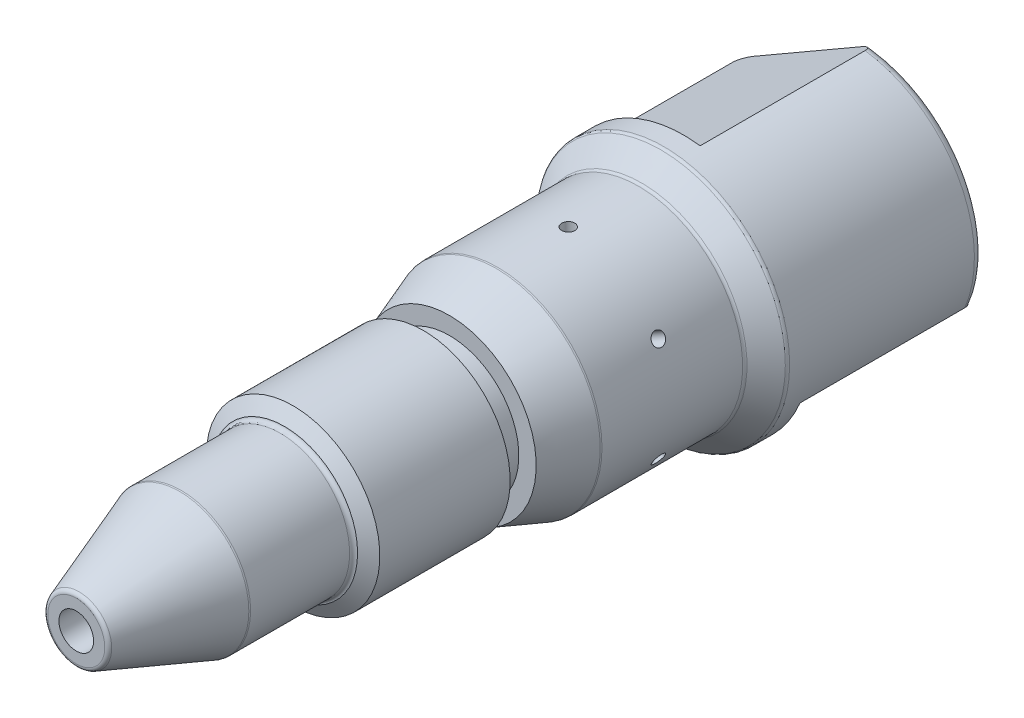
SolidWorks part; units mm, degrees
ref_plane "Front Plane" through (0, 0, 0) normal (0, 0, 1) x (1, 0, 0)
ref_plane "Top Plane" through (0, 0, 0) normal (0, 1, 0) x (1, 0, 0)
ref_plane "Right Plane" through (0, 0, 0) normal (1, 0, 0) x (0, 0, -1)
sketch "Sketch2" plane through (0, 0, 0) normal (0, 1, 0) x (1, 0, 0)
  line L0 (0, 0) -> (0, 45) construction
  line L1 (0, 45) -> (0, 0) construction
  line L2 (0, 0) -> (12.5, 0) construction
  line L4 (0, 0) -> (1.8162, 0)
  line L5 (1.8162, 0) -> (4, 6)
  line L6 (4, 6) -> (4, 12)
  line L7 (4, 12) -> (5, 12)
  line L8 (5, 12) -> (5, 20)
  line L9 (5, 20) -> (4, 20)
  line L10 (4, 20) -> (4, 21.5)
  line L11 (6, 24.2475) -> (6, 32.5)
  line L12 (6, 32.5) -> (7.25, 33.75)
  line L13 (7.25, 33.75) -> (7.25, 45)
  line L14 (0, 45) -> (0, 0)
  line L15 (0, 45) -> (7.25, 45)
  line L16 (4, 21.5) -> (5, 21.5)
  line L17 (5, 21.5) -> (6, 24.2475)
  point P20 (4.5, 20)
  dimension "D2" = 14.5
  dimension "D4" = 45
  dimension "D5" = 12
  dimension "D6" = 10
  dimension "D7" = 8
  dimension "D8" = 20
  dimension "D9" = 1.5
  dimension "D10" = 1
  dimension "D11" = 20
  dimension "D12" = 6
  dimension "D13" = 12
  dimension "D14" = 20
  dimension "D15" = 45
  dimension "D16" = 32.5
revolve "Revolve1" add sketch "Sketch2" angle 360 about L14
sketch "Sketch3" plane through (0, 0, 0) normal (0, 0, 1) x (1, 0, 0)
  circle A0 centre (0, 0) radius 1
  dimension "D1" = 2
extrude "Cut-Extrude1" cut sketch "Sketch3" against normal blind 23
sketch "Sketch4" plane through (0, 0, -45) normal (0, 0, -1) x (-1, 0, 0)
  circle A0 centre (0, 0) radius 3.75
  dimension "D1" = 7.5
extrude "Cut-Extrude3" cut sketch "Sketch4" against normal blind 23
chamfer "Chamfer1" distance 1 angle 60 1 edges at (-3.75, 0, -45)
chamfer "Chamfer2" distance 2.75 angle 45 1 edges at (-3.75, 0, -22)
fillet "Fillet9" radius 0.5 1 edges at (-7.25, 0, -45)
fillet "Fillet10" radius 0.25 6 edges at (-6, 0, -24.2475) (-7.25, 0, -33.75) (-6, 0, -32.5) (-4, 0, -6) (-4, 0, -12) (-1.8162, 0, 0)
ref_plane "Plane1" through (0, 10, 0) normal (0, 1, 0) x (1, 0, 0)
hole_wizard "Ø1.0 (0.75) Diameter Hole1" positions "Sketch6" profile "Sketch7" hole size "Ø1.0" standard "ANSI Metric"
sketch "Sketch6" plane through (0, 10, 0) normal (0, 1, 0) x (1, 0, 0)
  line L0 (0, 0) -> (0, 28.344) construction
  line L1 (-6, 28.344) -> (6, 28.344) construction
  line L4 (6, 24.2916) -> (6, 32.3964) construction
  line L5 (-6, 32.3964) -> (-6, 24.2916) construction
  point P0 (0, 28.344)
sketch "Sketch7" plane through (0, 10, -28.344) normal (1, 0, 0) x (0, 0, 1)
  line L0 (0, 0) -> (0, 6.25)
  line L1 (0, 6.25) -> (0.375, 6.25)
  line L2 (0.375, 6.25) -> (0.375, 0)
  line L5 (0.375, 0) -> (0, 0)
  line L11 (0, -6.35) -> (0, 107.95) construction
  dimension "Thru Hole Dia." = 0.75
  dimension "Thru Hole Depth" = 6.25
pattern_circular "CirPattern1" count 6 over 360 about axis through (0, 0, -45) along (0, 0, -1) of "Ø1.0 (0.75) Diameter Hole1"
sketch3d "CAMWorksSketchPoint"
  point P0 (-245.0099, -526, -383.1)
  point P1 (272.5, 373.5, 443)
chamfer "Chamfer3" distance 0.5 angle 60 1 edges at (-5, 0, -12)
fillet "Fillet11" radius 0.5 1 edges at (-3.75, 0, -24.75)
sketch "Sketch13" plane through (0, 10, 0) normal (0, 1, 0) x (1, 0, 0)
  line L0 (0, 45) -> (0, 0) construction
  line L2 (6.75, 45) -> (-6.75, 45) construction
ref_plane "Plane2" through (4.3301, 7.5, 0) normal (0.5, 0.866, 0) x (0, 0, 1)
sketch "Sketch19" plane through (0, 0, -45) normal (0, 0, -1) x (-1, 0, 0)
  line L0 (0, 0) -> (3.625, 6.2787) construction
  line L1 (-2.3212, 7.9796) -> (8.0712, 1.9796)
  line L2 (-2.3212, 7.9796) -> (-1.5712, 9.2787)
  line L3 (-1.5712, 9.2787) -> (8.8212, 3.2787)
  line L4 (8.0712, 1.9796) -> (8.8212, 3.2787)
  line L5 (0, 0) -> (10.1201, 0) construction
  line L10 (0, 0) -> (0, 7.25) construction
  line L11 (0, 0) -> (6.2787, -3.625) construction
  line L12 (-8.0712, -1.9796) -> (2.3212, -7.9796)
  line L13 (-8.0712, -1.9796) -> (-8.8212, -3.2787)
  line L14 (-8.8212, -3.2787) -> (1.5712, -9.2787)
  line L15 (2.3212, -7.9796) -> (1.5712, -9.2787)
  circle A0 centre (0, 0) radius 7.25 construction
  dimension "D1" = 12
  dimension "D2" = 1.5
  dimension "D3" = 30
  dimension "D4" = 30
extrude "Cut-Extrude5" cut sketch "Sketch19" against normal blind 10
sketch "Sketch20" plane through (0, 0, 0) normal (0, 1, 0) x (1, 0, 0)
  line L0 (4, 6.0441) -> (4, 11.75) construction
  line L1 (4.2113, 11.997) -> (5, 12.491) construction
  line L2 (5, 12.491) -> (5, 20) construction
  line L3 (4, 10.75) -> (4, 11.75)
  line L4 (4.2113, 11.997) -> (5, 12.491)
  line L5 (5, 12.491) -> (5, 13.491)
  arc A0 (4.2113, 11.997) -> (4, 11.75) centre (4.25, 11.75) ccw construction
  arc A1 (4.2113, 11.997) -> (4, 11.75) centre (4.25, 11.75) ccw
  dimension "D1" = 1
  dimension "D2" = 1
